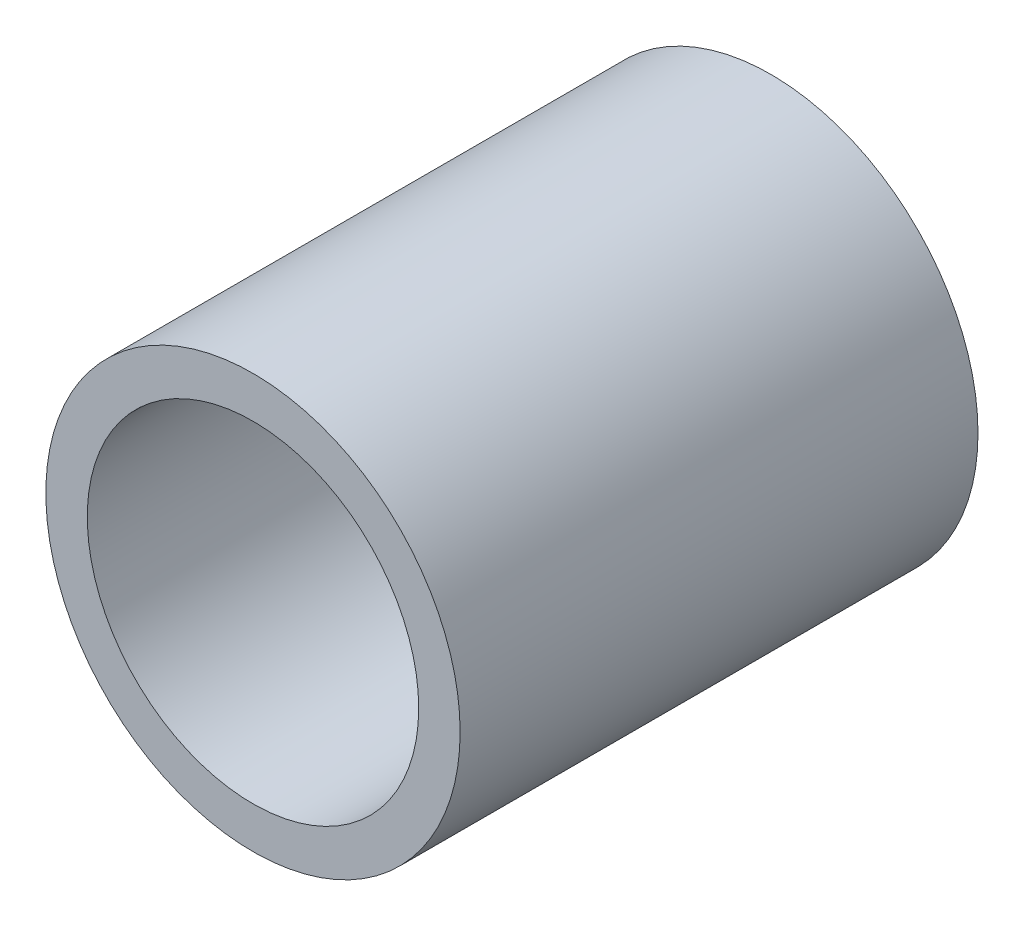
SolidWorks part; units mm, degrees
ref_plane "Plan1" through (0, 0, 0) normal (0, 0, 1) x (1, 0, 0)
ref_plane "Plan2" through (0, 0, 0) normal (0, 1, 0) x (1, 0, 0)
ref_plane "Plan3" through (0, 0, 0) normal (1, 0, 0) x (0, 0, -1)
sketch "Esquisse1" plane through (0, 0, 0) normal (0, 0, 1) x (1, 0, 0)
  circle A0 centre (0, 0) radius 2
  dimension "D1" = 4
extrude "Base-Extrusion" add sketch "Esquisse1" along normal blind 5
sketch "Esquisse2" plane through (0, 0, 5) normal (0, 0, 1) x (1, 0, 0)
  circle A0 centre (0, 0) radius 1.6
extrude "Enlèv. mat.-Extru.1" cut sketch "Esquisse2" against normal through all
